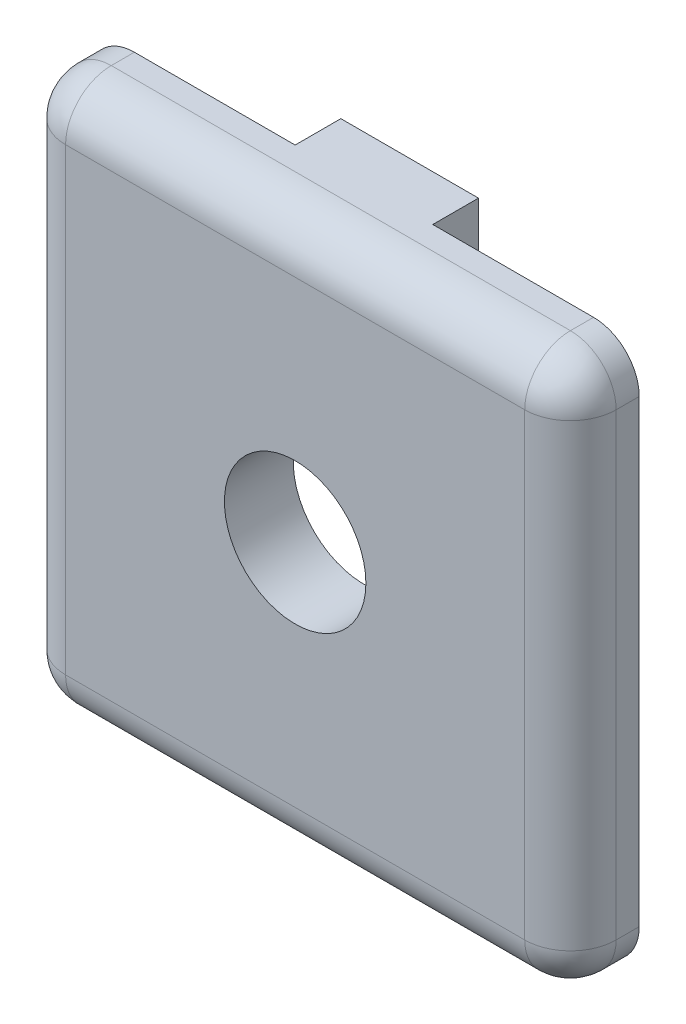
SolidWorks part; units mm, degrees
ref_plane "Front Plane" through (0, 0, 0) normal (0, 0, 1) x (1, 0, 0)
ref_plane "Top Plane" through (0, 0, 0) normal (0, 1, 0) x (1, 0, 0)
ref_plane "Right Plane" through (0, 0, 0) normal (1, 0, 0) x (0, 0, -1)
sketch "Sketch1" plane through (0, 0, 0) normal (0, 0, 1) x (1, 0, 0)
  line L0 (-12.7, 0) -> (12.7, 0) construction
  line L1 (-12.7, 12.7) -> (12.7, 12.7)
  line L2 (-12.7, 12.7) -> (-12.7, -12.7)
  line L3 (-12.7, -12.7) -> (12.7, -12.7)
  line L4 (12.7, 12.7) -> (12.7, -12.7)
  line L5 (0, 12.7) -> (0, -12.7) construction
  dimension "D1" = 25.4
  dimension "D2" = 25.4
extrude "Boss-Extrude1" add sketch "Sketch1" along normal blind 3.175
fillet "Fillet1" radius 2.1082 8 edges at (0, 12.7, 3.175) (12.7, 0, 3.175) (0, -12.7, 3.175) (-12.7, 0, 3.175) (-12.7, -12.7, 1.5875) (12.7, -12.7, 1.5875) (12.7, 12.7, 1.5875) (-12.7, 12.7, 1.5875)
sketch "Sketch2" plane through (0, 0, 3.175) normal (0, 0, 1) x (1, 0, 0)
  circle A0 centre (0, 0) radius 3.2639
  dimension "D2" = 6.5278
extrude "Cut-Extrude1" cut sketch "Sketch2" against normal up to next
sketch "Sketch3" plane through (0, 0, 0) normal (0, 0, -1) x (-1, 0, 0)
  line L0 (-10.5918, 12.7) -> (10.5918, 12.7) construction
  line L1 (-3.175, 12.7) -> (3.175, 12.7)
  line L2 (-3.175, 12.7) -> (-3.175, 10.5918)
  line L3 (-3.175, 10.5918) -> (3.175, 10.5918)
  line L4 (3.175, 12.7) -> (3.175, 10.5918)
  line L5 (0, 0) -> (0, 12.7) construction
  dimension "D1" = 6.35
  dimension "D2" = 2.1082
extrude "Boss-Extrude2" add sketch "Sketch3" along normal blind 2.1082
